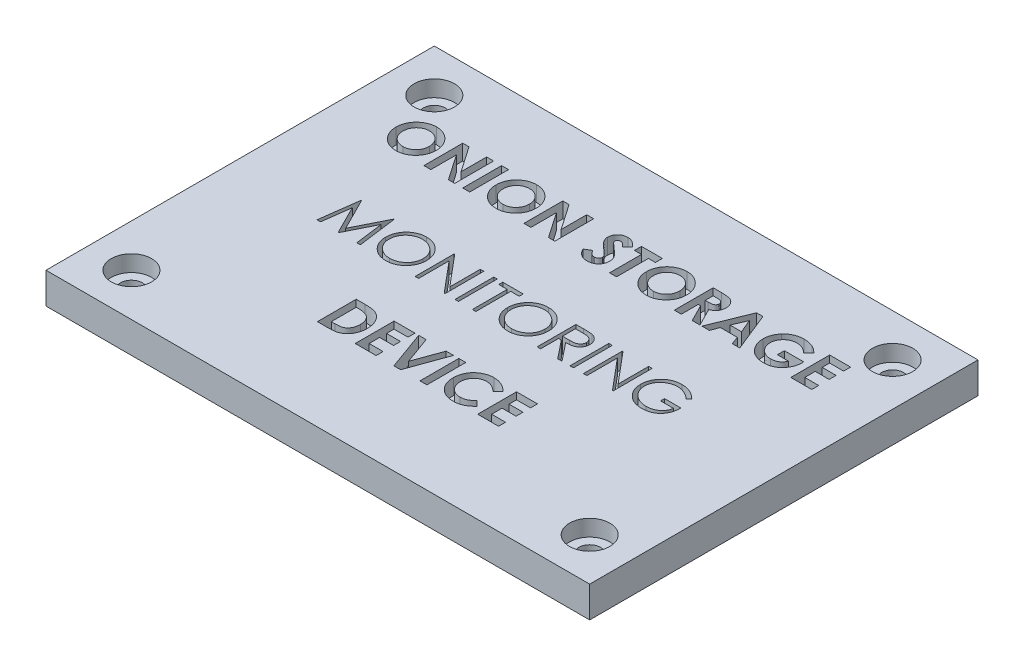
SolidWorks part; units mm, degrees
ref_plane "Front Plane" through (0, 0, 0) normal (0, 0, 1) x (1, 0, 0)
ref_plane "Top Plane" through (0, 0, 0) normal (0, 1, 0) x (1, 0, 0)
ref_plane "Right Plane" through (0, 0, 0) normal (1, 0, 0) x (0, 0, -1)
sketch "Sketch1" plane through (0, 0, 0) normal (0, 1, 0) x (1, 0, 0)
  line L1 (-35, 25) -> (35, 25)
  line L2 (-35, 25) -> (-35, -25)
  line L3 (-35, -25) -> (35, -25)
  line L4 (35, 25) -> (35, -25)
  line L5 (-35, 25) -> (35, -25) construction
  line L6 (-35, -25) -> (35, 25) construction
  point P4 (0, 0)
  point P5 (0, 0)
  dimension "D1" = 50
  dimension "D2" = 70
extrude "Boss-Extrude1" add sketch "Sketch1" along normal blind 4
sketch "Sketch2" plane through (0, 4, 0) normal (0, 1, 0) x (1, 0, 0)
  line L4 (0, 22) -> (0, -22) construction
  line L5 (-32, 22) -> (-27, 22) construction
  line L6 (-32, 22) -> (-32, 17) construction
  line L7 (-32, 17) -> (-27, 17) construction
  line L8 (-32, 22) -> (-32, -22)
  line L9 (-32, -22) -> (32, -22)
  line L10 (32, -22) -> (32, 22)
  line L11 (32, 22) -> (-32, 22)
  line L12 (-32, 22) -> (-32, -22) construction
  line L13 (-32, -22) -> (32, -22) construction
  line L14 (32, -22) -> (32, 22) construction
  line L15 (32, 22) -> (-32, 22) construction
  line L16 (-27, 22) -> (-27, 17) construction
  line L17 (-32, 22) -> (-27, 17) construction
  line L18 (-32, 17) -> (-27, 22) construction
  line L19 (32, 0) -> (-32, 0) construction
  circle A0 centre (-29.5, 19.5) radius 1.4
  circle A1 centre (29.5, 19.5) radius 1.4
  circle A2 centre (29.5, -19.5) radius 1.4
  circle A3 centre (-29.5, -19.5) radius 1.4
  point P3 (-29.5, 19.5)
  dimension "D4" = 2.8
  dimension "D2" = 5
  dimension "D3" = 5
  dimension "D1" = 3
extrude "Cut-Extrude1" cut sketch "Sketch2" against normal blind 14
sketch "Sketch3" plane through (0, 4, 0) normal (0, 1, 0) x (1, 0, 0)
  line L0 (0, 22) -> (0, -22) construction
  line L1 (-32, 22) -> (-27, 22) construction
  line L2 (-32, 22) -> (-32, 17) construction
  line L3 (-32, 17) -> (-27, 17) construction
  line L4 (-32, 22) -> (-32, -22) construction
  line L5 (-32, -22) -> (32, -22) construction
  line L6 (32, -22) -> (32, 22) construction
  line L7 (32, 22) -> (-32, 22) construction
  line L8 (-27, 22) -> (-27, 17) construction
  line L9 (-32, 22) -> (-27, 17) construction
  line L10 (-32, 17) -> (-27, 22) construction
  line L11 (32, 0) -> (-32, 0) construction
  circle A0 centre (-29.5, 19.5) radius 2.6
  circle A1 centre (29.5, 19.5) radius 2.6
  circle A2 centre (29.5, -19.5) radius 2.6
  circle A3 centre (-29.5, -19.5) radius 2.6
  point P3 (-29.5, 19.5)
  point P20 (0, 0)
  dimension "D1" = 5.2
extrude "Cut-Extrude2" cut sketch "Sketch3" against normal blind 2.1
sketch "Sketch4" plane through (0, 4, 0) normal (0, 1, 0) x (1, 0, 0)
  line L0 (-35, 10.9958) -> (35, 10.9958) construction
  line L1 (-35, 25) -> (-35, -25) construction
  line L2 (35, -25) -> (35, 25) construction
  line L3 (-35, -1.9271) -> (35, -1.9271) construction
  line L4 (-35, -13.2629) -> (35, -13.2629) construction
  text T0 "<b>ONION STORAGE</b>" font "Century Gothic" height 5
  text T1 "MONITORING " font "Century Gothic" height 5
  text T2 "<b>DEVICE</b>" font "Century Gothic" height 5
extrude "Cut-Extrude3" cut sketch "Sketch4" against normal blind 2
